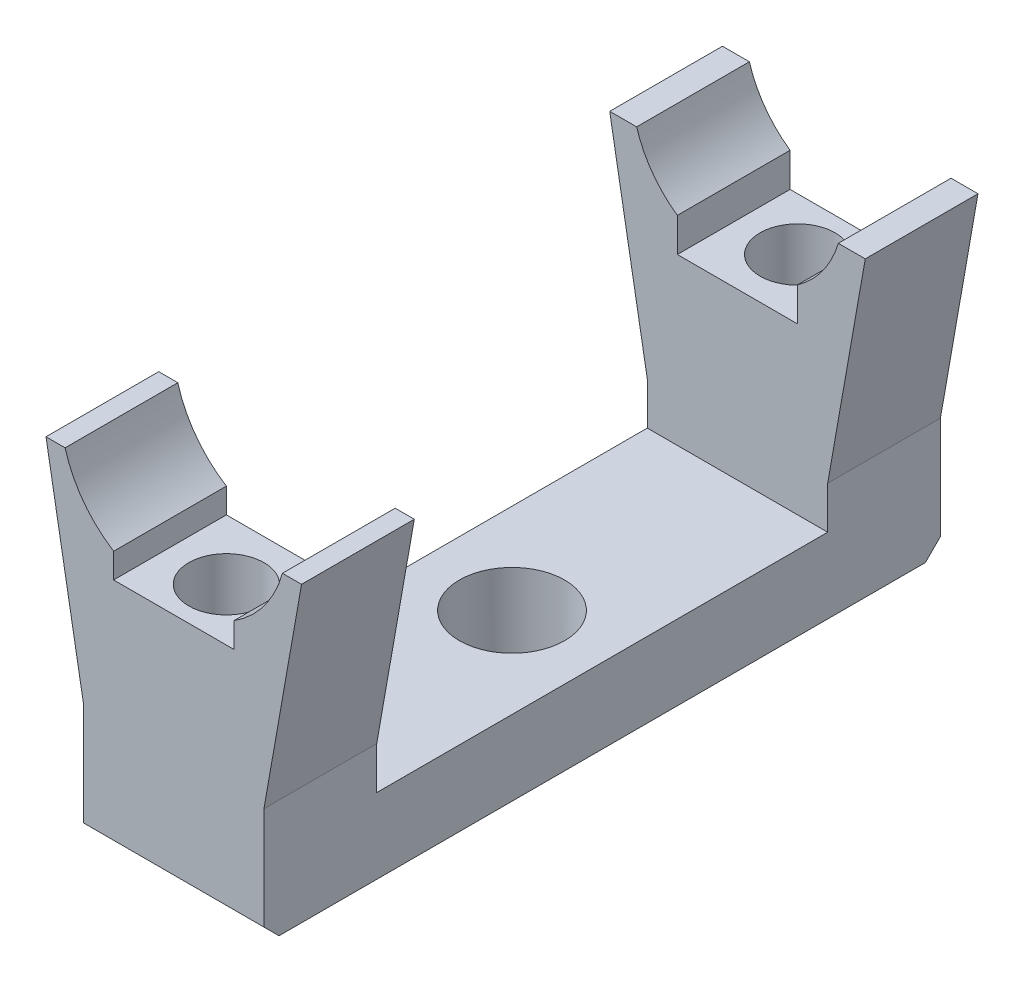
SolidWorks part; units mm, degrees
ref_plane "前视基准面" through (0, 0, 0) normal (0, 0, 1) x (1, 0, 0)
ref_plane "上视基准面" through (0, 0, 0) normal (0, 1, 0) x (1, 0, 0)
ref_plane "右视基准面" through (0, 0, 0) normal (1, 0, 0) x (0, 0, -1)
sketch "草图1" plane through (0, 0, 0) normal (0, 0, 1) x (1, 0, 0)
  line L0 (0, -6.2403) -> (0, 17.2146) construction
  line L1 (11.953, 0) -> (-17.3091, 0) construction
  line L2 (-6.7082, 15.4448) -> (-8.5, 15.4448)
  line L3 (-8.5, 15.4448) -> (-6, 1.2666)
  line L4 (-6, 1.2666) -> (-6, -6.5552)
  line L5 (-6, -6.5552) -> (6, -6.5552)
  line L6 (-4, 11.7002) -> (-4, 9.4448)
  line L7 (-4, 9.4448) -> (4, 9.4448)
  line L8 (6, 1.2666) -> (6, -6.5552)
  line L9 (8.5, 15.4448) -> (6, 1.2666)
  line L10 (6.7082, 15.4448) -> (8.5, 15.4448)
  line L11 (4, 11.7002) -> (4, 9.4448)
  arc A0 (-6.7082, 15.4448) -> (-4, 11.7002) centre (0, 17.4448) ccw
  arc A1 (6.7082, 15.4448) -> (4, 11.7002) centre (0, 17.4448) cw
  point P29 (0, -6.5552)
  point P31 (0, 9.4448)
  dimension "D2" = 7
  dimension "D1" = 4
  dimension "D3" = 10
  dimension "D4" = 16
  dimension "D5" = 6
  dimension "D6" = 8.5
  dimension "D7" = 24
  dimension "D8" = 22
extrude "凸台-拉伸1" add sketch "草图1" along normal mid plane 45
sketch "草图2" plane through (0, 0, 22.5) normal (0, 0, 1) x (1, 0, 0)
  circle A0 centre (0, 17.4448) radius 7.5
extrude "切除-拉伸1" cut sketch "草图2" against normal blind 7.5
sketch "草图3" plane through (-6, 0, 0) normal (-1, 0, 0) x (0, 0, 1)
  line L0 (22.5, -6.5552) -> (-22.5, -6.5552) construction
  line L1 (-15, -1.5552) -> (15, -1.5552)
  line L2 (-15, -1.5552) -> (-15, 23.8521)
  line L3 (-15, 23.8521) -> (15, 23.8521)
  line L4 (15, -1.5552) -> (15, 23.8521)
  line L5 (-15, -1.5552) -> (15, 23.8521) construction
  line L6 (-15, 23.8521) -> (15, -1.5552) construction
  line L7 (22.5, 15.4448) -> (22.5, 1.2666) construction
  line L8 (-22.5, 15.4448) -> (-22.5, 1.2666) construction
  point P0 (0, 0)
  point P6 (0, 0)
  dimension "D1" = 5
  dimension "D2" = 7.5
  dimension "D3" = 7.5
extrude "切除-拉伸2" cut sketch "草图3" against normal through all both and the other way through all
hole_wizard "M6 螺纹孔1" positions "草图4" profile "草图5" tap size "M6" standard "GB"
sketch "草图4" plane through (0, 9.4448, 0) normal (0, 1, 0) x (1, 0, 0)
  point P0 (0, 19)
  point P2 (0, -19)
  dimension "D1" = 19
  dimension "D2" = 19
sketch "草图5" plane through (0, 9.4448, -19) normal (1, 0, 0) x (0, 0, 1)
  line L0 (0, 0) -> (0, 13.5022)
  line L1 (0, 13.5022) -> (2.5, 12)
  line L2 (2.5, 12) -> (2.5, 0)
  line L5 (2.5, 0) -> (0, 0)
  line L10 (0, 13.5022) -> (-2.5, 12) construction
  line L11 (0, -6.35) -> (0, 107.95) construction
  dimension "螺纹孔钻头直径" = 5
  dimension "螺纹孔钻头深度" = 12
  dimension "导头角度" = 118
sketch "草图8" plane through (0, -1.5552, 0) normal (0, 1, 0) x (1, 0, 0)
  circle A0 centre (0, 0) radius 3.5
extrude "切除-拉伸3" cut sketch "草图8" against normal through all both and the other way through all
chamfer "倒角1" distance 1 angle 45 2 edges at (0, -6.5552, 22.5) (0, -6.5552, -22.5)
